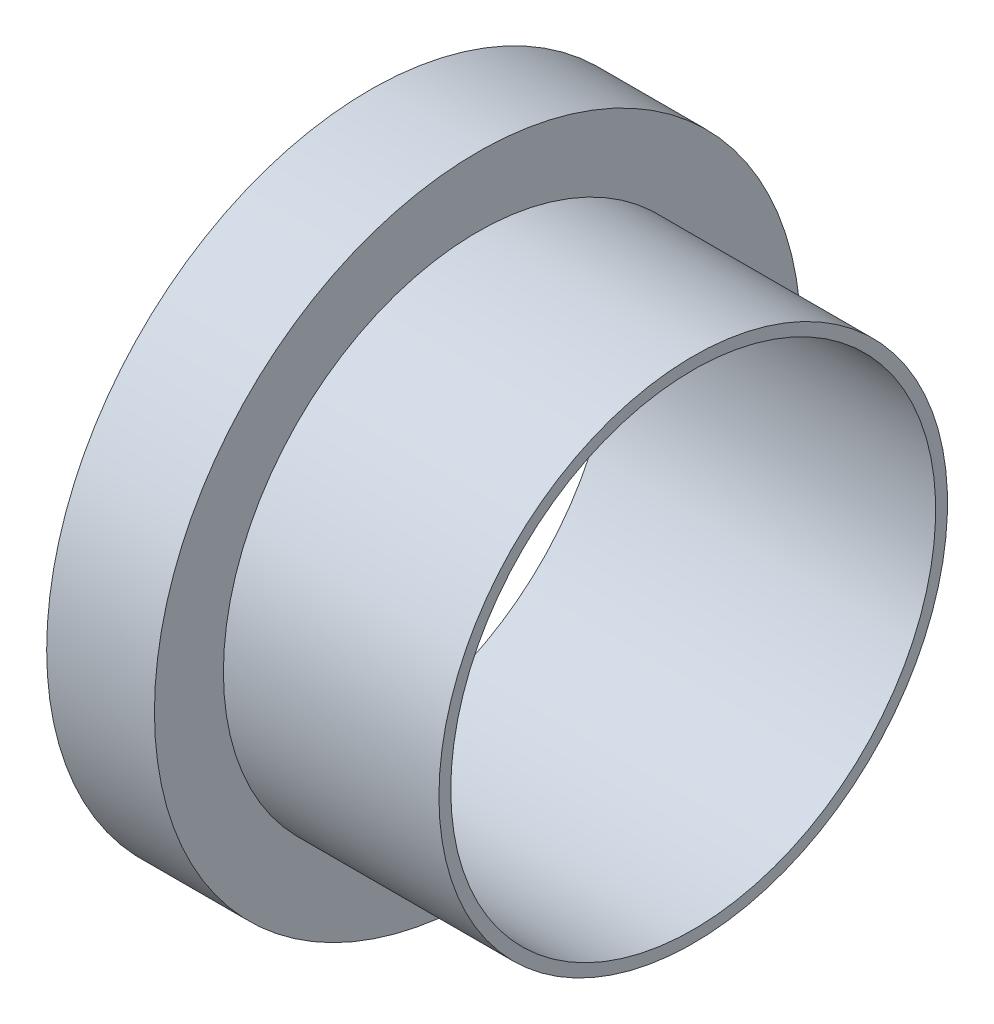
SolidWorks part; units mm, degrees
ref_plane "Front Plane" through (0, 0, 0) normal (0, 0, 1) x (1, 0, 0)
ref_plane "Top Plane" through (0, 0, 0) normal (0, 1, 0) x (1, 0, 0)
ref_plane "Right Plane" through (0, 0, 0) normal (1, 0, 0) x (0, 0, -1)
sketch "Sketch1" plane through (0, 0, 0) normal (0, 0, 1) x (1, 0, 0)
  line L0 (0, 0) -> (45.378, 0) construction
  line L1 (0, 14.2875) -> (19.05, 14.2875)
  line L2 (19.05, 14.2875) -> (19.05, 14.986)
  line L3 (19.05, 14.986) -> (6.35, 14.986)
  line L4 (6.35, 14.986) -> (6.35, 19.05)
  line L5 (6.35, 19.05) -> (0, 19.05)
  line L6 (0, 19.05) -> (0, 14.2875)
  dimension "D1" = 28.575
  dimension "D2" = 29.972
  dimension "D3" = 6.35
  dimension "D4" = 12.7
  dimension "D5" = 38.1
revolve "Revolve1" add sketch "Sketch1" angle 360 about L0
